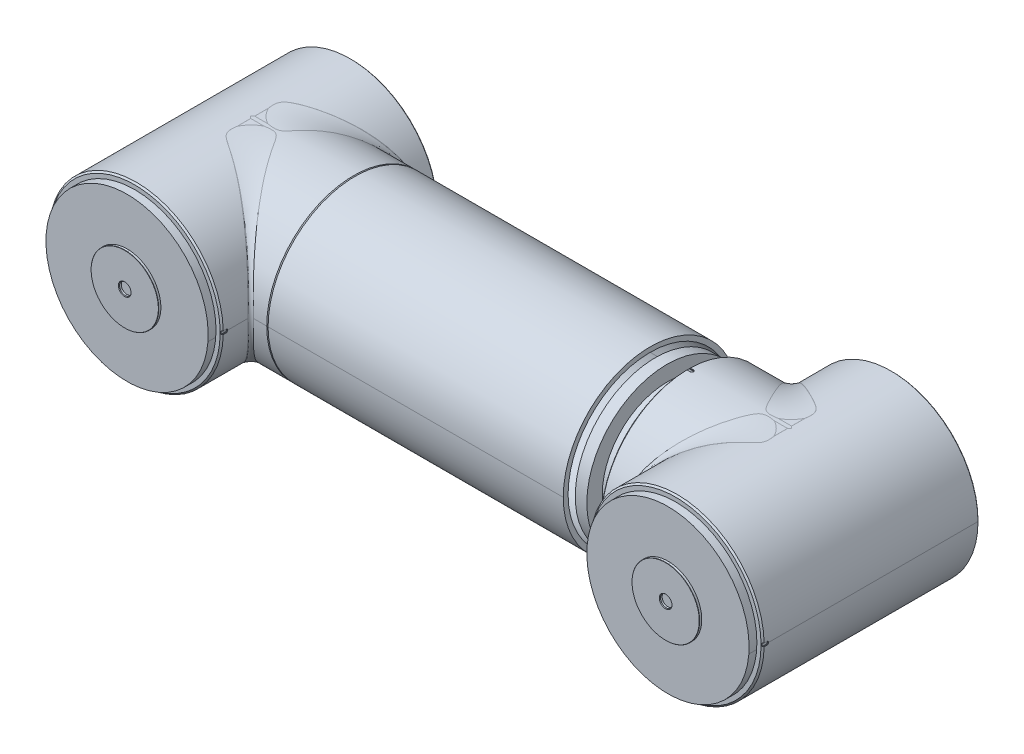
SolidWorks part; units mm, degrees
ref_plane "前视基准面" through (0, 0, 0) normal (0, 0, 1) x (1, 0, 0)
ref_plane "上视基准面" through (0, 0, 0) normal (0, 1, 0) x (1, 0, 0)
ref_plane "右视基准面" through (0, 0, 0) normal (1, 0, 0) x (0, 0, -1)
imported_body "17关节-1-solid1"
imported_body "大臂-1-solid1"
imported_body "大臂-1-solid2"
imported_body "17关节-2-solid1"
sketch "草图1" plane through (0, 0, 0) normal (0, 1, 0) x (1, 0, 0)
  line L0 (-5.5, 52) -> (-94.5, 52) construction
  line L1 (-116.9246, 107.9697) -> (298.9673, 107.9697)
  line L2 (-116.9246, 107.9697) -> (-116.9246, 52)
  line L3 (-116.9246, 52) -> (298.9673, 52)
  line L4 (298.9673, 107.9697) -> (298.9673, 52)
extrude "切除-拉伸1" cut sketch "草图1" against normal mid plane 291
sketch "草图2" plane through (175.8, 0, 0) normal (1, 0, 0) x (0, 0, -1)
  circle A0 centre (0, 0) radius 41.5
  dimension "D1" = 83
extrude "切除-拉伸3" cut sketch "草图2" against normal blind 19 flip side to cut
